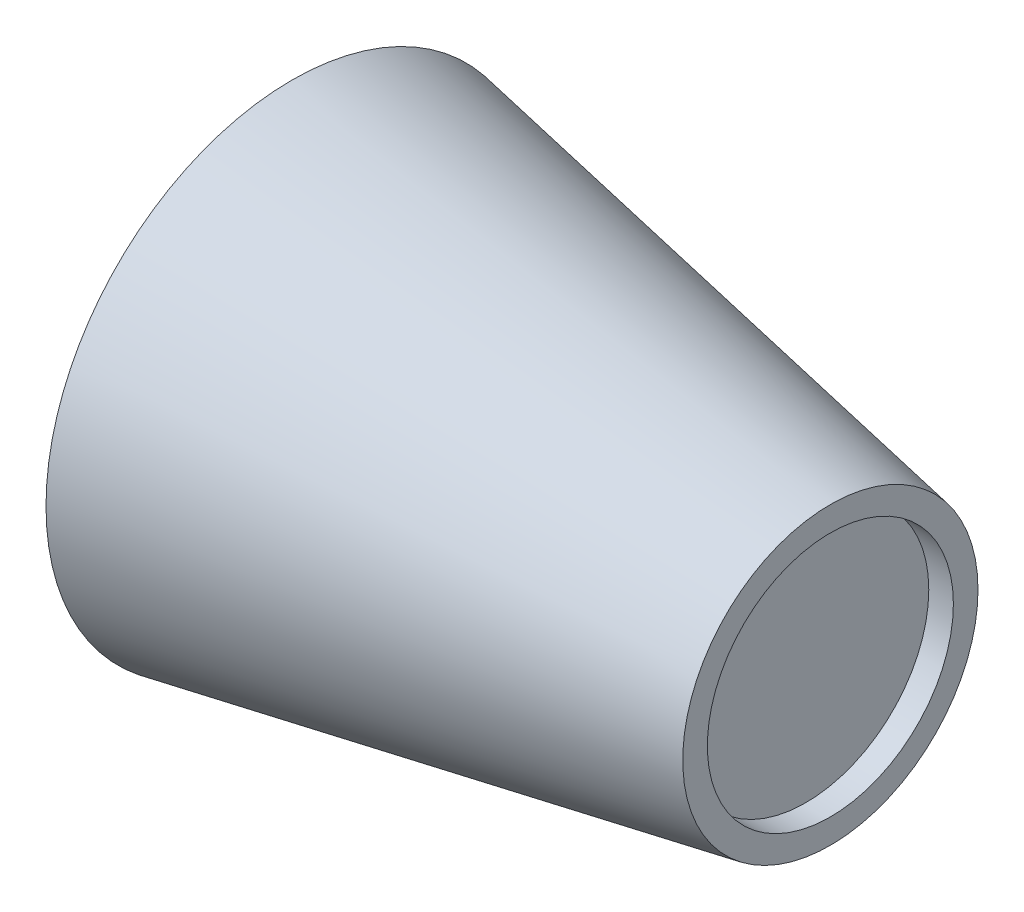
SolidWorks part; units mm, degrees
ref_plane "Front" through (0, 0, 0) normal (0, 0, 1) x (1, 0, 0)
ref_plane "Top" through (0, 0, 0) normal (0, 1, 0) x (1, 0, 0)
ref_plane "Right" through (0, 0, 0) normal (1, 0, 0) x (0, 0, -1)
sketch "Sketch1" plane through (0, 0, 0) normal (0, 1, 0) x (1, 0, 0)
  line L0 (21.88, 34.8345) -> (21.88, 35.8345)
  line L1 (15.88, 29.8345) -> (15.88, 33.0095)
  line L2 (15.88, 33.0095) -> (0, 33.0095)
  line L3 (0, 33.0095) -> (0, 39.8345)
  line L4 (21.88, 35.8345) -> (0, 39.8345)
  line L6 (21.88, 34.8345) -> (20.88, 34.8345)
  line L7 (20.88, 34.8345) -> (20.88, 29.8345)
  line L8 (20.88, 29.8345) -> (15.88, 29.8345)
  dimension "D1" = 1
  dimension "D2" = 10
  dimension "D3" = 3.175
  dimension "D4" = 5
revolve "Revolve1" add sketch "Sketch1" angle 360 about L8
